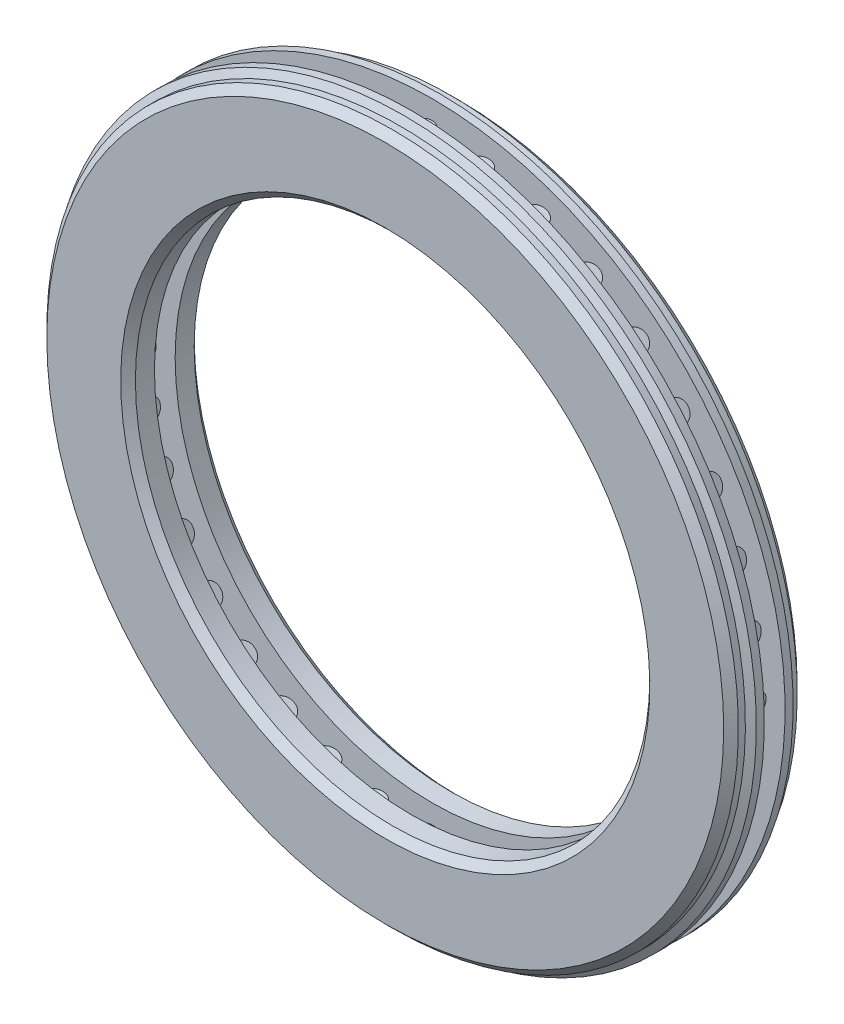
SolidWorks part; units mm, degrees
ref_plane "Front Plane" through (0, 0, 0) normal (0, 0, 1) x (1, 0, 0)
ref_plane "Top Plane" through (0, 0, 0) normal (0, 1, 0) x (1, 0, 0)
ref_plane "Right Plane" through (0, 0, 0) normal (1, 0, 0) x (0, 0, -1)
sketch "BaseSke" plane through (0, 0, 0) normal (1, 0, 0) x (0, 0, -1)
  line L0 (-47.2296, 0) -> (24.6132, 0) construction
  line L2 (0, 129.5214) -> (0, -86.3012) construction
  line L3 (-5, 48) -> (-5, 35) construction
  line L4 (-5, 48) -> (5, 48) construction
  line L5 (-5, 35) -> (5, 35) construction
  line L6 (-1.4286, 37.6) -> (0, 37.6)
  line L7 (-1.4286, 37.6) -> (-1.4286, 45.4)
  line L8 (-1.4286, 45.4) -> (0, 45.4)
  line L9 (0, 37.6) -> (0, 45.4)
  line L11 (5, 48) -> (5, 35) construction
  line L12 (-5, 41.5) -> (5, 41.5) construction
  line L13 (1.4286, 45.4) -> (1.4286, 37.6) construction
  dimension "D2" = 7.8
  dimension "D1" = 1.4286
  dimension "Bearing_Thickness" = 10
  dimension "Bearing_Outside_Diameter" = 96
  dimension "Bearing_Inside_Diameter" = 70
revolve "Roller" add sketch "BaseSke" angle 360 about L2
sketch "ThrustPSke" plane through (0, 0, 0) normal (1, 0, 0) x (0, 0, -1)
  line L0 (-5, 35) -> (5, 35) construction
  line L1 (-2.5, 48) -> (-1.4086, 48)
  line L2 (-5, 47.0548) -> (-5, 35)
  line L3 (-5, 35) -> (-1.4086, 35)
  line L4 (-1.4086, 48) -> (-1.4086, 35)
  line L5 (-5, 48) -> (5, 48) construction
  line L6 (-1.4286, 37.6) -> (-1.4286, 45.4) construction
  line L7 (-5, 48) -> (-5, 35) construction
  line L8 (0, 0) -> (0, 48.3549) construction
  line L10 (-5, 47.0548) -> (-3.0457, 47.0548)
  line L11 (-2.5, 48) -> (-3.0457, 47.0548)
  line L12 (0, 129.5214) -> (0, -86.3012) construction
  line L13 (5, 35) -> (1.4086, 35)
  line L14 (1.4086, 48) -> (1.4086, 35)
  line L15 (2.5, 48) -> (1.4086, 48)
  line L16 (2.5, 48) -> (3.0457, 47.0548)
  line L17 (5, 47.0548) -> (3.0457, 47.0548)
  line L18 (5, 47.0548) -> (5, 35)
  line L19 (-10.1337, 0) -> (10.1337, 0) construction
  dimension "D1" = 0.02
  dimension "D2" = 5
  dimension "D3" = 30
revolve "ThrustPlates" add sketch "ThrustPSke" angle 360 about L19
chamfer "Chamfer1" distance 1 angle 45 4 edges at (0, -35, 5) (0, -35, -5) (0, -47.0548, 5) (0, -47.0548, -5)
pattern_circular "CirPatternBall" count 36 over 360 about axis through (0, 0, 0) along (0, 0, 1) of "Roller"
sketch "SimplifiedSke" plane through (0, 0, 0) normal (1, 0, 0) x (0, 0, -1)
  line L1 (1.4286, 37.6) -> (-1.4286, 37.6)
  line L2 (1.4286, 37.6) -> (1.4286, 45.4)
  line L3 (1.4286, 45.4) -> (-1.4286, 45.4)
  line L4 (-1.4286, 37.6) -> (-1.4286, 45.4)
  line L5 (0, 0) -> (-31.7458, 0) construction
revolve "Simplified" [suppressed] add sketch "SimplifiedSke" angle 360 about L5
equation "\"D1@BaseSke\" = \"Bearing_Thickness@BaseSke\"/7"
equation "\"D2@BaseSke\" =  ( \"Bearing_Outside_Diameter@BaseSke\" - \"Bearing_Inside_Diameter@BaseSke\" )  * 0.3"
equation "\"D2@ThrustPSke\" = \"Bearing_Thickness@BaseSke\" * 0.5"
equation "\"D1@CirPatternBall\" =  int( \"Bearing_Outside_Diameter@BaseSke\" *  pi   / \"Bearing_Thickness@BaseSke\" * 1.2) "
